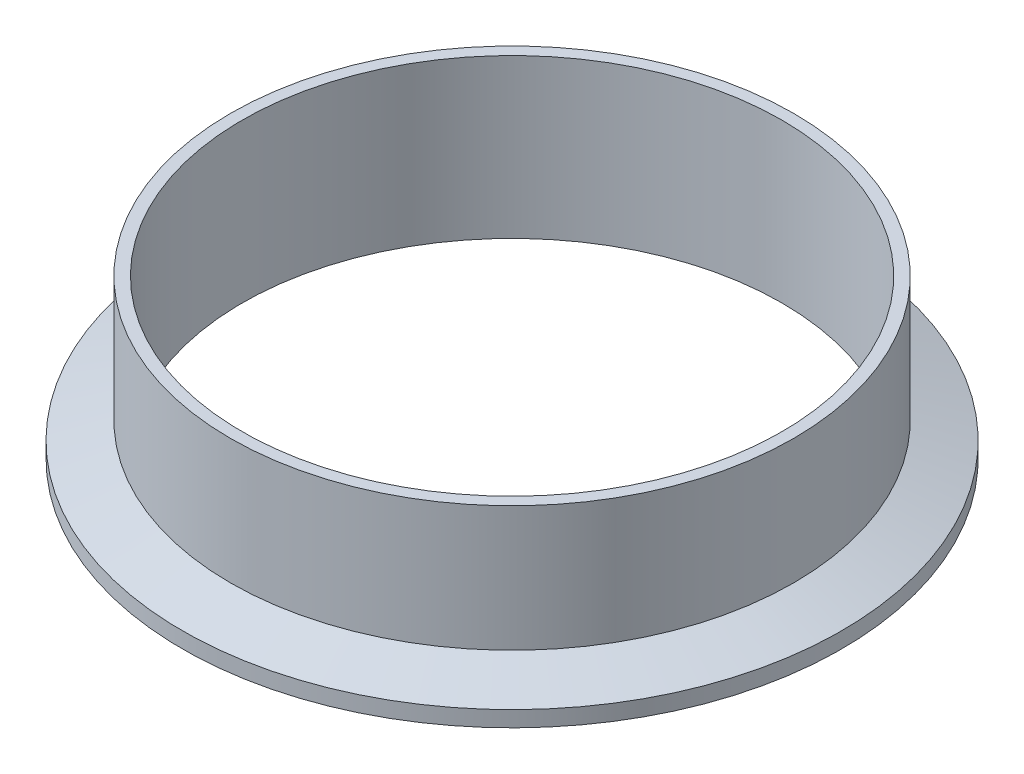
SolidWorks part; units mm, degrees
ref_plane "Front Plane" through (0, 0, 0) normal (0, 0, 1) x (1, 0, 0)
ref_plane "Top Plane" through (0, 0, 0) normal (0, 1, 0) x (1, 0, 0)
ref_plane "Right Plane" through (0, 0, 0) normal (1, 0, 0) x (0, 0, -1)
sketch "Sketch1" plane through (0, 0, 0) normal (0, 0, 1) x (1, 0, 0)
  line L0 (0, 0) -> (0, 28.575) construction
  line L1 (0, 28.575) -> (-50.8, 28.575)
  line L2 (-50.8, 28.575) -> (-50.8, 5.9973)
  line L3 (-50.8, 5.9973) -> (-59.4614, 2.8448)
  line L4 (-59.4614, 2.8448) -> (-59.4614, 0)
  line L5 (-59.4614, 0) -> (-56.6185, 0)
  line L6 (-52.9825, 0) -> (0, 0)
  line L7 (0, 0) -> (0, 28.575)
  line L8 (0, 28.575) -> (-48.6918, 28.575)
  line L9 (-48.6918, 28.575) -> (-48.6918, 0)
  line L10 (-48.6918, 0) -> (0, 0)
  line L11 (0, 0) -> (-0.1846, 0.0129)
  arc A0 (-55.896, 0.4745) -> (-53.705, 0.4745) centre (-54.8005, 0) cw
  arc A1 (-52.9825, 0) -> (-53.705, 0.4745) centre (-52.9825, 0.7874) cw
  arc A2 (-55.896, 0.4745) -> (-56.6185, 0) centre (-56.6185, 0.7874) cw
  point P12 (-53.6067, 0)
  dimension "D6" = 1.1938
  dimension "D7" = 0.7874
  dimension "D1" = 50.8
  dimension "D2" = 2.8448
  dimension "D3" = 59.4614
  dimension "D4" = 70
  dimension "D5" = 54.8005
  dimension "D8" = 2.1082
  dimension "D9" = 28.575
revolve "Revolve2" add sketch "Sketch1" angle 360 about L0
